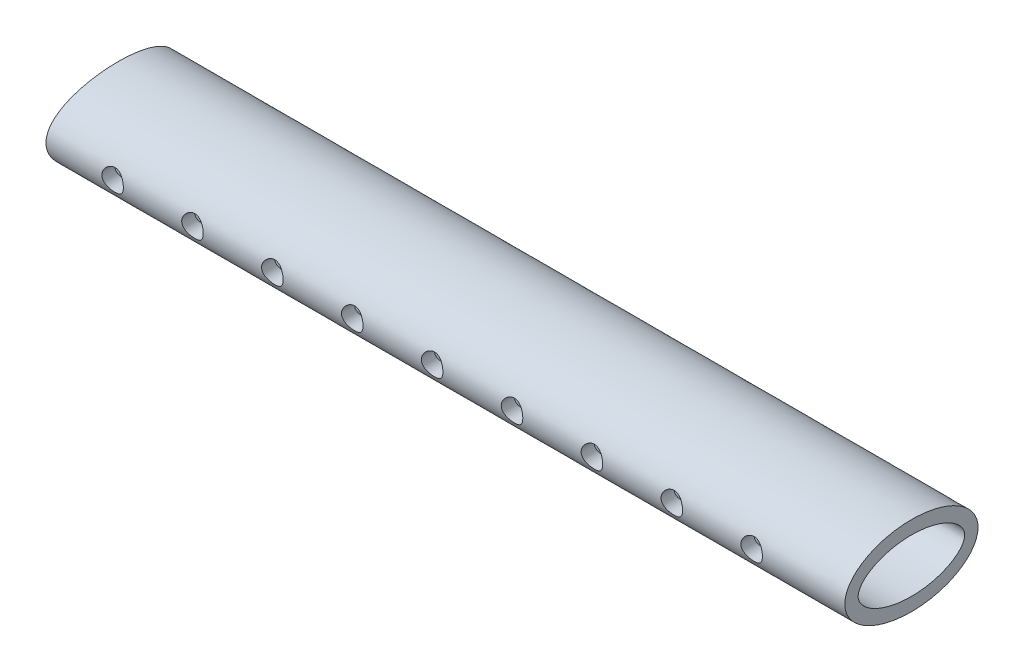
SolidWorks part; units mm, degrees
ref_plane "Front Plane" through (0, 0, 0) normal (0, 0, 1) x (1, 0, 0)
ref_plane "Top Plane" through (0, 0, 0) normal (0, 1, 0) x (1, 0, 0)
ref_plane "Right Plane" through (0, 0, 0) normal (1, 0, 0) x (0, 0, -1)
sketch "Sketch1" plane through (0, 0, 0) normal (1, 0, 0) x (0, 0, -1)
  ellipse E0 centre (0, 0) end of major axis (24.9997, 0) minor radius 15
  dimension "D1" = 49.9994
  dimension "D2" = 30
extrude "Boss-Extrude1" add sketch "Sketch1" along normal blind 300
sketch "Sketch2" plane through (0, 0, 0) normal (0, 1, 0) x (1, 0, 0)
  line L0 (0, 24.9997) -> (0, 33.9716)
  line L1 (0, 33.9716) -> (-30.354, 33.9716)
  line L2 (-30.354, 33.9716) -> (-30.354, -30.986)
  line L3 (-30.354, -30.986) -> (0, -30.986)
  line L4 (0, -30.986) -> (0, -24.9997)
  arc A0 (0, -24.9997) -> (0, 24.9997) centre (-147.902, 0) ccw
  dimension "D1" = 150
extrude "Cut-Extrude3" cut sketch "Sketch2" against normal mid plane 400
sketch "Sketch3" plane through (300, 0, 0) normal (1, 0, 0) x (0, 0, -1)
  spline S0 degree 3 number of poles 101 (-19.9997, 0) -> (-19.9997, 0)
  spline S1 degree 3 number of poles 101 (-19.9997, 0) -> (-19.9997, 0)
  dimension "D3" = 5
extrude "Cut-Extrude4" cut sketch "Sketch3" against normal through all
sketch "Sketch4" plane through (0, 0, 0) normal (0, 0, 1) x (1, 0, 0)
  circle A0 centre (25, 0) radius 4.0441
  dimension "D1" = 25
extrude "Cut-Extrude5" cut sketch "Sketch4" against normal mid plane 60
pattern_linear "LPattern1" count 9 spacing 30 along (1, 0, 0) of "Cut-Extrude5"
